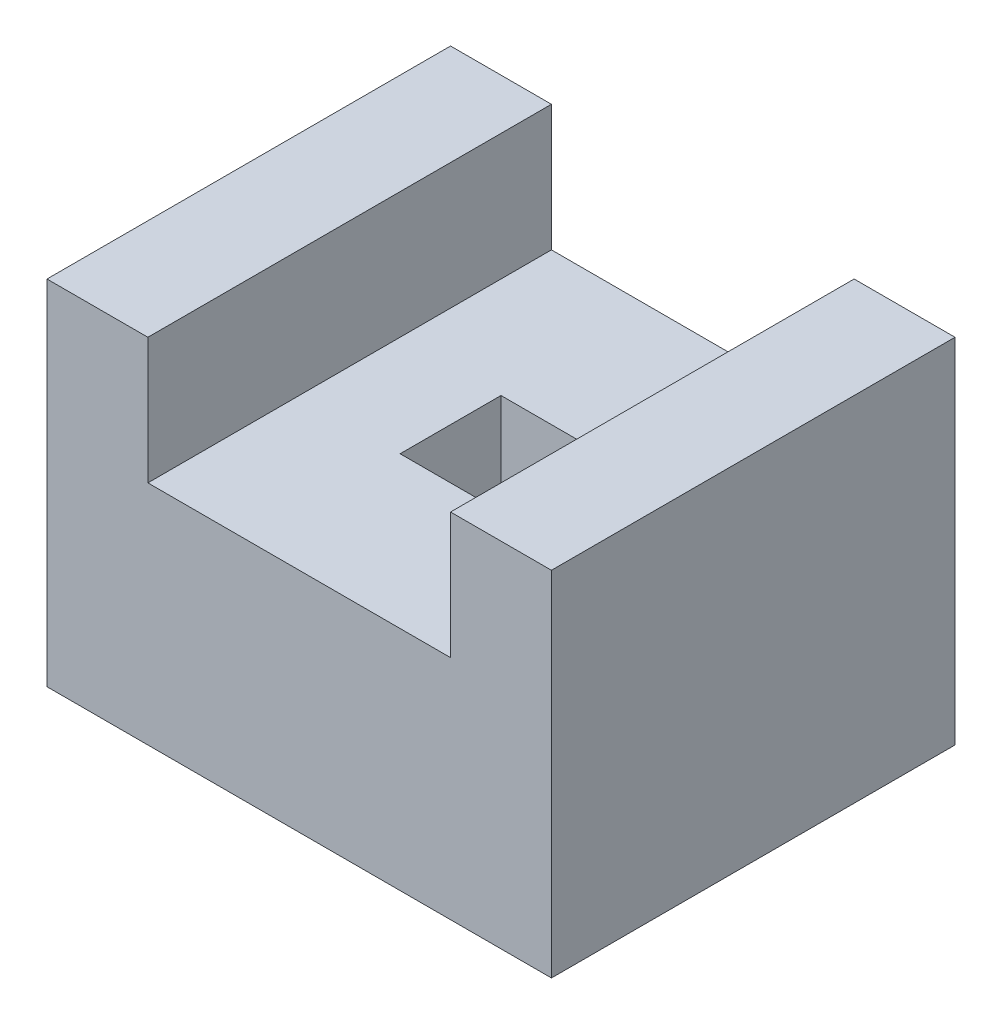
SolidWorks part; units mm, degrees
ref_plane "前视基准面" through (0, 0, 0) normal (0, 0, 1) x (1, 0, 0)
ref_plane "上视基准面" through (0, 0, 0) normal (0, 1, 0) x (1, 0, 0)
ref_plane "右视基准面" through (0, 0, 0) normal (1, 0, 0) x (0, 0, -1)
sketch "草图1" plane through (0, 0, 0) normal (0, 0, 1) x (1, 0, 0)
  line L0 (0, 0) -> (0, 78.2802) construction
  line L1 (0, 78.2802) -> (0, 0) construction
  line L2 (0, 0) -> (96.7463, 0) construction
  line L3 (30, 35) -> (30, 10)
  line L4 (-50, 35) -> (-30, 35)
  line L5 (-50, 35) -> (-50, -35)
  line L6 (-50, -35) -> (50, -35)
  line L7 (50, 35) -> (50, -35)
  line L8 (30, 10) -> (-30, 10)
  line L9 (-30, 10) -> (-30, 35)
  line L10 (30, 35) -> (50, 35)
  dimension "D1" = 100
  dimension "D2" = 20
  dimension "D3" = 25
  dimension "D4" = 70
extrude "拉伸1" add sketch "草图1" against normal blind 80
sketch "草图2" plane through (0, 10, 0) normal (0, 1, 0) x (1, 0, 0)
  line L0 (0, 0) -> (0, 80) construction
  line L1 (30, 0) -> (-30, 0) construction
  line L2 (30, 80) -> (-30, 80) construction
  line L3 (0, 40) -> (48.5914, 40) construction
  line L5 (-10, 50) -> (10, 50)
  line L6 (-10, 50) -> (-10, 30)
  line L7 (-10, 30) -> (10, 30)
  line L8 (10, 50) -> (10, 30)
extrude "切除-拉伸1" cut sketch "草图2" against normal through all
